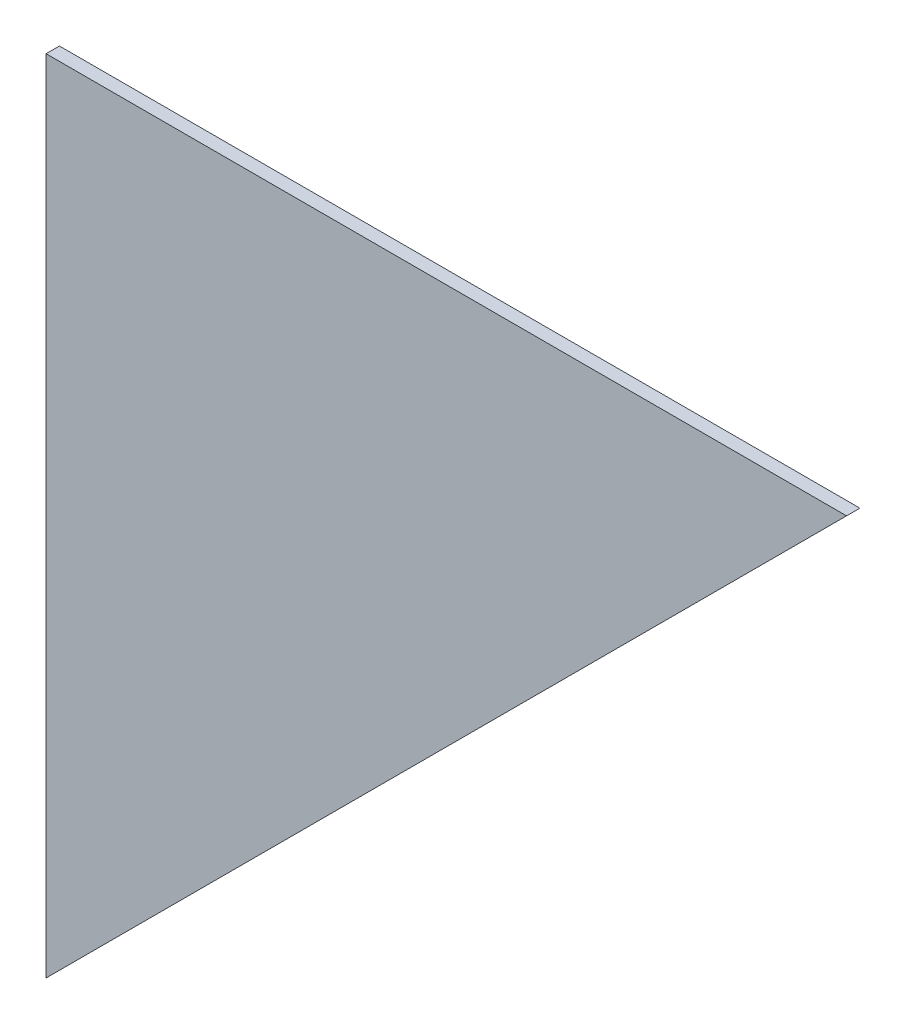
SolidWorks part; units mm, degrees
ref_plane "Front Plane" through (0, 0, 0) normal (0, 0, 1) x (1, 0, 0)
ref_plane "Top Plane" through (0, 0, 0) normal (0, 1, 0) x (1, 0, 0)
ref_plane "Right Plane" through (0, 0, 0) normal (1, 0, 0) x (0, 0, -1)
sketch "Sketch1" plane through (0, 0, 0) normal (0, 0, 1) x (1, 0, 0)
  line L0 (0, 0) -> (152.4, 0)
  line L1 (0, 0) -> (0, -152.4)
  line L2 (0, -152.4) -> (152.4, 0)
  dimension "D1" = 152.4
  dimension "D2" = 152.4
extrude "Boss-Extrude1" add sketch "Sketch1" along normal blind 2.54
